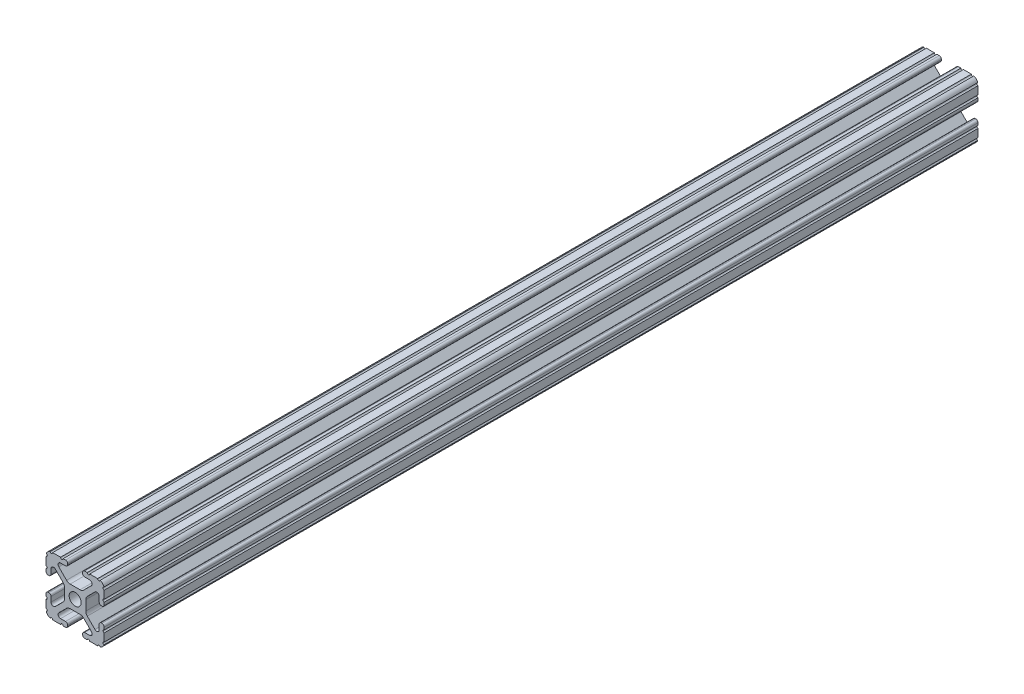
SolidWorks part; units mm, degrees
ref_plane "Front Plane" through (0, 0, 0) normal (0, 0, 1) x (1, 0, 0)
ref_plane "Top Plane" through (0, 0, 0) normal (0, 1, 0) x (1, 0, 0)
ref_plane "Right Plane" through (0, 0, 0) normal (1, 0, 0) x (0, 0, -1)
sketch "Sketch2" plane through (0, 0, 0) normal (0, 0, 1) x (1, 0, 0)
  line L0 (0, 12.7) -> (0, -12.7) construction
  line L1 (-12.7, 0) -> (12.7, 0) construction
  line L2 (3.2512, -12.7) -> (12.7, -12.7)
  line L3 (12.7, -12.7) -> (12.7, -3.2512)
  line L4 (3.2512, -12.7) -> (3.2512, -10.4902)
  line L5 (3.2512, -10.4902) -> (8.9276, -10.4902)
  line L6 (8.9276, -10.4902) -> (3.0856, -4.6482)
  line L7 (0, 0) -> (12.7, -12.7) construction
  line L8 (12.7, -3.2512) -> (10.4902, -3.2512)
  line L9 (10.4902, -3.2512) -> (10.4902, -8.9276)
  line L10 (10.4902, -8.9276) -> (4.6482, -3.0856)
  circle A0 centre (0, 0) radius 2.6035
  arc A1 (6.3485, -10.4902) -> (7.1039, -8.6665) centre (6.3485, -9.4219) ccw construction
  point P8 (0, -4.6482)
sketch "Sketch3" plane through (0, 0, 0) normal (1, 0, 0) x (0, 0, -1)
  line L0 (-228.6, -12.7) -> (228.6, -12.7) construction
  line L1 (-205.74, 0) -> (205.74, 0) construction
sketch "Sketch4" plane through (0, 0, 0) normal (0, 0, 1) x (1, 0, 0)
  line L0 (4.1904, -12.7) -> (10.1173, -12.7)
  line L1 (3.2512, -12.7) -> (12.7, -12.7) construction
  line L2 (3.2512, -12.7) -> (3.2512, -10.4902) construction
  line L3 (3.2512, -10.4902) -> (8.9276, -10.4902) construction
  line L4 (3.2512, -11.4294) -> (3.2512, -11.7608)
  line L5 (4.1904, -10.4902) -> (6.3485, -10.4902)
  line L6 (0, -4.6482) -> (2.164, -4.6482)
  line L7 (8.9276, -10.4902) -> (3.0856, -4.6482) construction
  line L8 (3.7373, -5.2999) -> (7.1039, -8.6665)
  line L9 (12.7, -12.7) -> (12.7, -3.2512) construction
  line L10 (10.4902, -8.9276) -> (4.6482, -3.0856) construction
  line L11 (10.4902, -3.2512) -> (10.4902, -8.9276) construction
  line L12 (10.4902, -6.3485) -> (10.4902, -4.1904)
  line L13 (12.7, -3.2512) -> (10.4902, -3.2512) construction
  line L14 (11.4294, -3.2512) -> (11.7608, -3.2512)
  line L15 (12.7, -4.1904) -> (12.7, -10.1173)
  line L16 (8.6665, -7.1039) -> (5.2999, -3.7373)
  line L17 (4.6482, 0) -> (4.6482, -2.164)
  line L18 (-12.7, 0) -> (12.7, 0) construction
  line L19 (0, -4.6482) -> (0, -2.6035)
  line L20 (0, 12.7) -> (0, -12.7) construction
  line L21 (4.6482, 0) -> (2.6035, 0)
  arc A0 (3.2512, -11.7608) -> (4.1904, -12.7) centre (4.1904, -11.7608) ccw
  arc A2 (3.2512, -11.4294) -> (4.1904, -10.4902) centre (4.1904, -11.4294) cw
  arc A3 (6.3485, -10.4902) -> (7.1039, -8.6665) centre (6.3485, -9.4219) ccw
  arc A4 (2.164, -4.6482) -> (3.7373, -5.2999) centre (2.164, -6.8732) cw
  arc A5 (10.1173, -12.7) -> (12.7, -10.1173) centre (10.1173, -10.1173) ccw
  arc A6 (8.6665, -7.1039) -> (10.4902, -6.3485) centre (9.4219, -6.3485) ccw
  arc A7 (10.4902, -4.1904) -> (11.4294, -3.2512) centre (11.4294, -4.1904) cw
  arc A8 (11.7608, -3.2512) -> (12.7, -4.1904) centre (11.7608, -4.1904) cw
  arc A9 (5.2999, -3.7373) -> (4.6482, -2.164) centre (6.8732, -2.164) cw
  circle A10 centre (0, 0) radius 2.6035 construction
  arc A11 (0, -2.6035) -> (2.6035, 0) centre (0, 0) ccw
extrude "Boss-Extrude1" add sketch "Sketch4" along normal mid plane 381
sketch "Sketch5" plane through (0, 0, 0) normal (0, 0, 1) x (1, 0, 0)
  line L0 (3.2512, -12.7) -> (12.7, -12.7) construction
  line L1 (4.1904, -10.4902) -> (6.3485, -10.4902) construction
  line L3 (0, 0) -> (12.7, -12.7) construction
  line L4 (6.3485, -10.4902) -> (6.3485, -12.7) construction
  line L5 (8.9276, -10.4902) -> (3.0856, -4.6482) construction
  circle A0 centre (10.3562, -12.7) radius 0.5524
  circle A1 centre (5.796, -12.7) radius 0.5524
  circle A2 centre (12.7, -10.3562) radius 0.5524
  circle A3 centre (12.7, -5.796) radius 0.5524
  point P10 (5.2694, -10.4902)
  point P12 (9.4219, -6.3485)
extrude "Cut-Extrude1" cut sketch "Sketch5" against normal through all both and the other way through all
mirror "Mirror1" about plane through (0, 0, 0) normal (1, 0, 0)
mirror "Mirror2" about plane through (0, 0, 0) normal (0, 1, 0)
equation "\"D1@Boss-Extrude1\"=\"Length@Sketch3\""
equation "\"D1@Sketch2\"=\"Thickness@Sketch2\""
equation "\"D2@Sketch4\"=\"Slot Inner Width@Sketch2\"*0.15"
equation "\"D1@Sketch4\"=\"D3@Sketch4\"*2.75"
equation "\"D3@Sketch4\"=\"Thickness@Sketch2\"*0.425"
equation "\"D1@Sketch5\"=\"Thickness@Sketch2\"*0.5"
equation "\"D1@Sketch3\"=\"Length@Sketch3\"*0.9"
